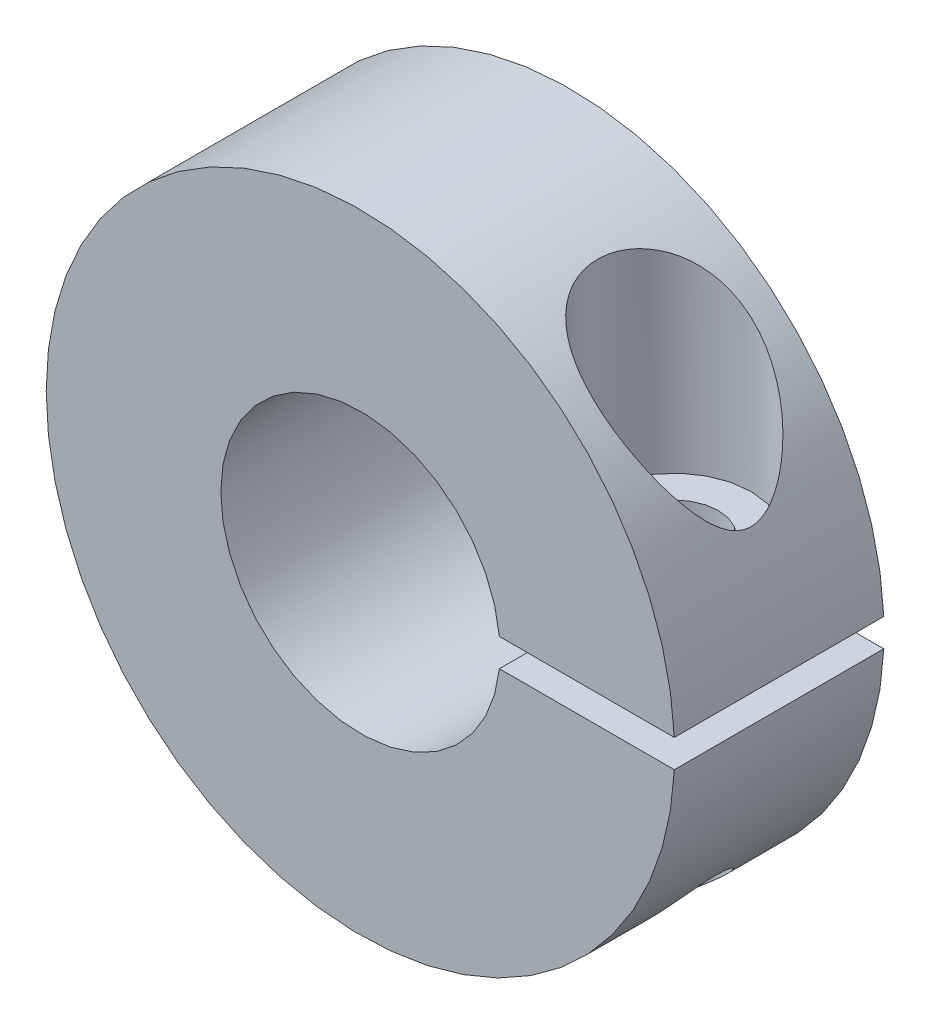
SolidWorks part; units mm, degrees
ref_plane "前基準面" through (0, 0, 0) normal (0, 0, 1) x (1, 0, 0)
ref_plane "上基準面" through (0, 0, 0) normal (0, 1, 0) x (1, 0, 0)
ref_plane "右基準面" through (0, 0, 0) normal (1, 0, 0) x (0, 0, -1)
sketch "草圖1" plane through (0, 0, 0) normal (0, 0, 1) x (1, 0, 0)
  circle A0 centre (0, 0) radius 10
  circle A1 centre (0, 0) radius 22.5
  dimension "D1" = 20
  dimension "D2" = 45
extrude "填料-伸長1" add sketch "草圖1" along normal blind 15
sketch "草圖2" plane through (0, 0, 15) normal (0, 0, 1) x (1, 0, 0)
  line L0 (0, 0) -> (22.5, 0) construction
  line L2 (2.7638, 1) -> (27.655, 1)
  line L3 (2.7638, 1) -> (2.7638, -1)
  line L4 (2.7638, -1) -> (27.655, -1)
  line L5 (27.655, 1) -> (27.655, -1)
  circle A0 centre (0, 0) radius 22.5 construction
  dimension "D1" = 2
extrude "除料-伸長1" cut sketch "草圖2" against normal through all
sketch "草圖5" plane through (0, -1, 0) normal (0, 1, 0) x (1, 0, 0)
  line L0 (22.4778, -7.5) -> (9.9499, -7.5) construction
  line L1 (22.4778, -15) -> (22.4778, 0) construction
  line L2 (9.9499, -15) -> (9.9499, 0) construction
  circle A0 centre (14.9778, -7.5) radius 3
  point P4 (16.2138, -7.5)
  dimension "D1" = 6
  dimension "D2" = 7.5
extrude "除料-伸長2" cut sketch "草圖5" against normal through all
sketch "草圖7" plane through (0, 1, 0) normal (0, -1, 0) x (1, 0, 0)
  circle A0 centre (14.9778, 7.5) radius 3.15
  dimension "D1" = 6.3
extrude "除料-伸長3" cut sketch "草圖7" against normal through all
ref_plane "平面2" through (0, 6, 0) normal (0, -1, 0) x (1, 0, 0)
sketch "草圖8" plane through (0, 6, 0) normal (0, -1, 0) x (1, 0, 0)
  circle A0 centre (14.9778, 7.5) radius 5.5
  dimension "D1" = 11
extrude "除料-伸長4" cut sketch "草圖8" against normal through all
